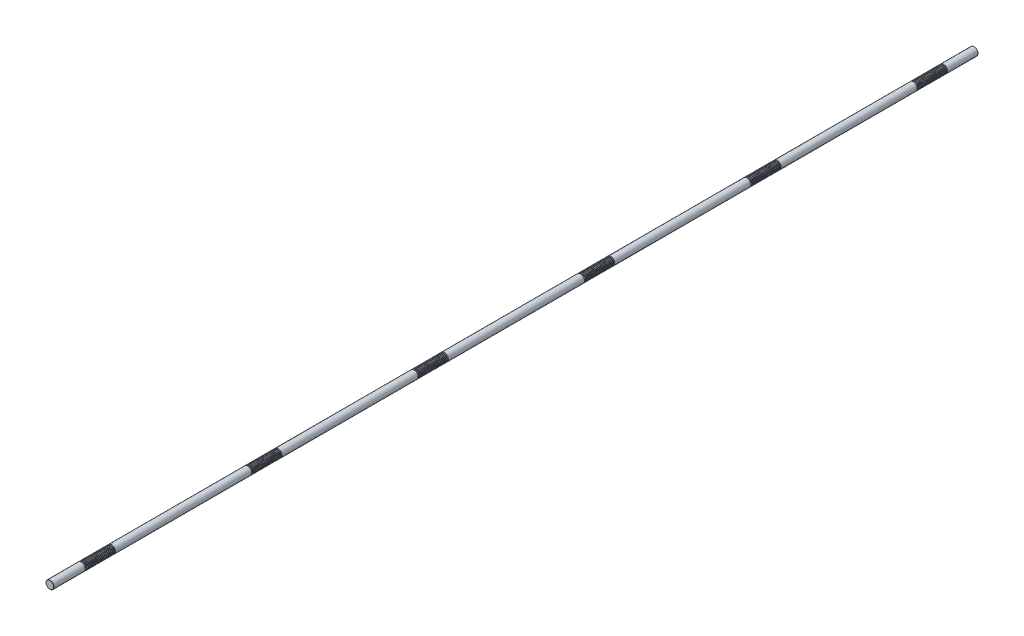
SolidWorks part; units mm, degrees
ref_plane "Front Plane" through (0, 0, 0) normal (0, 0, 1) x (1, 0, 0)
ref_plane "Top Plane" through (0, 0, 0) normal (0, 1, 0) x (1, 0, 0)
ref_plane "Right Plane" through (0, 0, 0) normal (1, 0, 0) x (0, 0, -1)
sketch "Sketch1" plane through (0, 0, 0) normal (0, 0, 1) x (1, 0, 0)
  circle A0 centre (0, 0) radius 13
  dimension "D1" = 26
extrude "Boss-Extrude1" add sketch "Sketch1" along normal mid plane 3000
chamfer "Chamfer1" distance 0.65 angle 45 2 edges at (13, 0, -1500) (13, 0, 1500)
sketch "Sketch2" plane through (0, 0, 0) normal (1, 0, 0) x (0, 0, -1)
  line L0 (1400.3684, 13) -> (1397.1316, 13)
  line L1 (1499.35, 13) -> (-1499.35, 13) construction
  line L2 (1397.1316, 13) -> (1397.8684, 10.25)
  line L3 (1397.8684, 10.25) -> (1399.6316, 10.25)
  line L4 (1399.6316, 10.25) -> (1400.3684, 13)
  line L5 (1500, -12.35) -> (1500, 12.35) construction
  point P4 (1398.75, 13)
  point P7 (1398.75, 10.25)
  point P8 (1400, 11.625)
  point P9 (1397.5, 11.625)
  dimension "D1" = 2.5
  dimension "D2" = 100
  dimension "D3" = 2.75
  dimension "D4" = 30
revolve "Cut-Revolve1" cut sketch "Sketch2" angle 360 about axis through (0, 0, 1500) along (0, 0, -1)
pattern_linear "LPattern1" count 20 spacing 5 along (0, 0, 1) of "Cut-Revolve1"
pattern_linear "LPattern2" count 6 spacing 540 along (0, 0, 1) of "Cut-Revolve1", "LPattern1"
